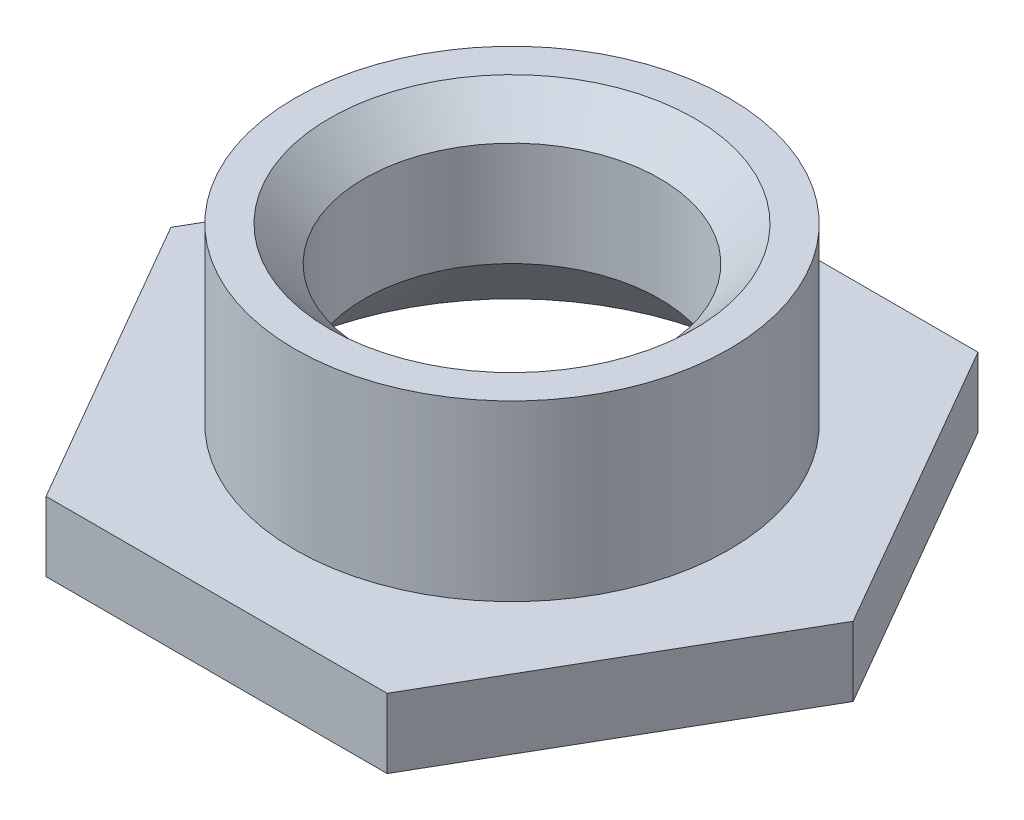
SolidWorks part; units mm, degrees
ref_plane "Спереди" through (0, 0, 0) normal (0, 0, 1) x (1, 0, 0)
ref_plane "Сверху" through (0, 0, 0) normal (0, 1, 0) x (1, 0, 0)
ref_plane "Справа" through (0, 0, 0) normal (1, 0, 0) x (0, 0, -1)
sketch "Эскиз1" plane through (0, 0, 0) normal (0, 1, 0) x (1, 0, 0)
  line L1 (9.815, 0) -> (4.9075, 8.5)
  line L2 (4.9075, 8.5) -> (-4.9075, 8.5)
  line L3 (-4.9075, 8.5) -> (-9.815, 0)
  line L4 (-9.815, 0) -> (-4.9075, -8.5)
  line L5 (-4.9075, -8.5) -> (4.9075, -8.5)
  line L6 (4.9075, -8.5) -> (9.815, 0)
  circle A0 centre (0, 0) radius 8.5 construction
  dimension "D1" = 17
extrude "Бобышка-Вытянуть1" add sketch "Эскиз1" along normal blind 2
sketch "Эскиз2" plane through (0, 2, 0) normal (0, 1, 0) x (1, 0, 0)
  circle A0 centre (0, 0) radius 6.25
  dimension "D1" = 12.5
extrude "Бобышка-Вытянуть2" add sketch "Эскиз2" along normal blind 5
sketch "Эскиз3" plane through (0, 7, 0) normal (0, 1, 0) x (1, 0, 0)
  circle A0 centre (0, 0) radius 4.25
  dimension "D1" = 8.5
extrude "Вырез-Вытянуть1" cut sketch "Эскиз3" against normal through all
chamfer "Фаска1" distance 1 angle 45 1 edges at (0, 7, 4.25)
chamfer "Фаска2" distance 3 angle 45 1 edges at (0, 0, 4.25)
